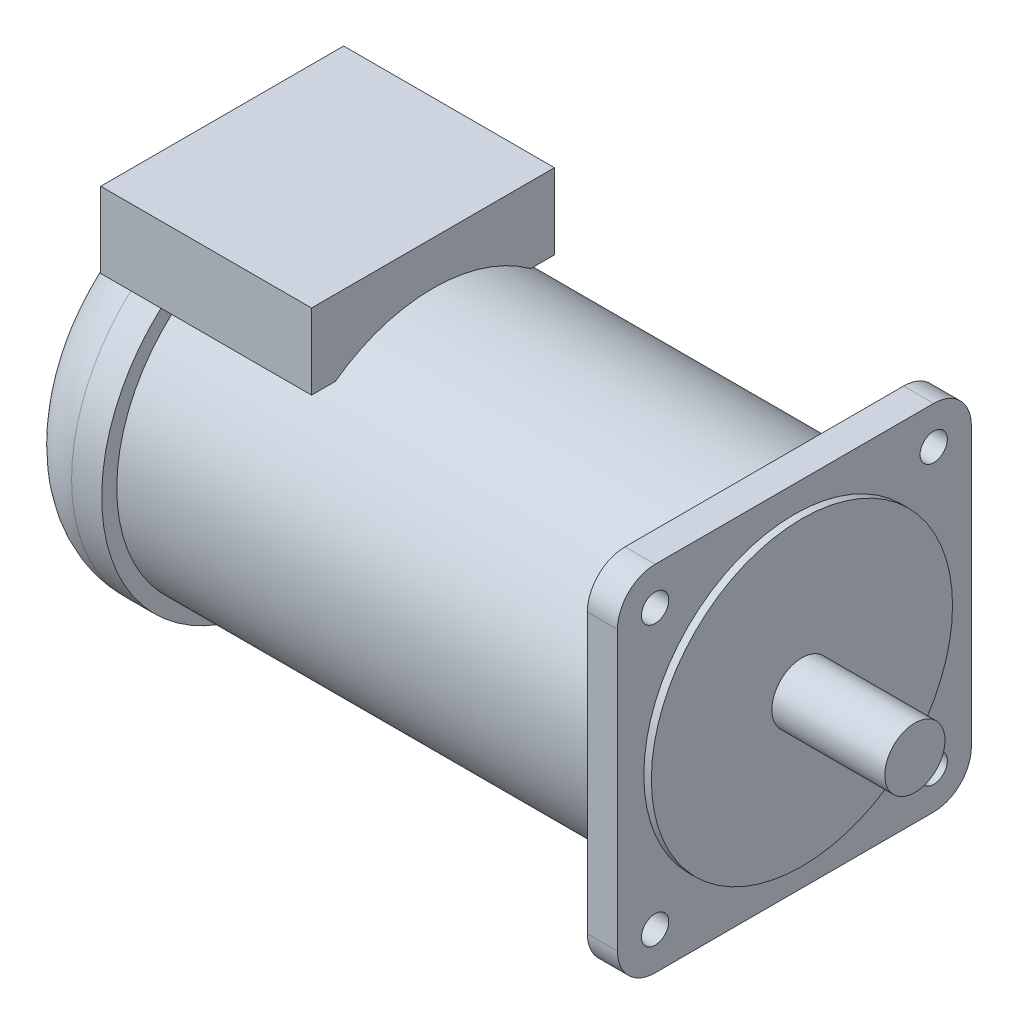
SolidWorks part; units mm, degrees
ref_plane "front" through (0, 0, 0) normal (0, 0, 1) x (1, 0, 0)
ref_plane "top" through (0, 0, 0) normal (0, 1, 0) x (1, 0, 0)
ref_plane "side" through (0, 0, 0) normal (1, 0, 0) x (0, 0, -1)
sketch "Sketch1" plane through (0, 0, 0) normal (0, 0, 1) x (1, 0, 0)
  line L0 (0, 0) -> (63.4876, 0) construction
  line L1 (0, 0) -> (0, 12.7)
  line L2 (0, 12.7) -> (-50.8, 12.7)
  line L3 (-50.8, 12.7) -> (-50.8, 69.85)
  line L6 (-50.8, 69.85) -> (-266.7, 69.85)
  line L7 (-266.7, 69.85) -> (-266.7, 76.2)
  line L8 (-266.7, 76.2) -> (-279.4, 76.2)
  line L9 (-304.8, 50.8) -> (-304.8, 0)
  line L10 (-304.8, 0) -> (0, 0)
  arc A0 (-279.4, 76.2) -> (-304.8, 50.8) centre (-279.4, 50.8) ccw
  dimension "D3" = 25.4
  dimension "D1" = 69.85
  dimension "D2" = 76.2
  dimension "D4" = 38.1
  dimension "D5" = 254
  dimension "D6" = 50.8
  dimension "D7" = 25.4
revolve "Base-Revolve" add sketch "Sketch1" angle 360 about L0
sketch "Sketch2" plane through (-50.8, 0, 0) normal (1, 0, 0) x (0, 0, -1)
  line L0 (0, 0) -> (0, 105.8986) construction
  line L1 (0, 0) -> (105.8986, 0) construction
  line L2 (74.6125, -58.7375) -> (74.6125, 58.7375)
  line L3 (58.7375, 74.6125) -> (-58.7375, 74.6125)
  line L4 (-74.6125, -58.7375) -> (-74.6125, 58.7375)
  line L5 (58.7375, -74.6125) -> (-58.7375, -74.6125)
  arc A0 (74.6125, 58.7375) -> (58.7375, 74.6125) centre (58.7375, 58.7375) ccw
  arc A1 (-74.6125, 58.7375) -> (-58.7375, 74.6125) centre (-58.7375, 58.7375) cw
  arc A2 (-74.6125, -58.7375) -> (-58.7375, -74.6125) centre (-58.7375, -58.7375) ccw
  arc A3 (74.6125, -58.7375) -> (58.7375, -74.6125) centre (58.7375, -58.7375) cw
  point P10 (0, 74.6125)
  point P11 (74.6125, 0)
  point P18 (-74.6125, 0)
  point P19 (0, -74.6125)
  dimension "D1" = 15.875
  dimension "D2" = 149.225
extrude "Boss-Extrude1" add sketch "Sketch2" against normal blind 12.7
ref_plane "Plane4" through (-203.2, 0, 0) normal (1, 0, 0) x (0, 0, -1)
sketch "Sketch3" plane through (-203.2, 0, 0) normal (1, 0, 0) x (0, 0, -1)
  line L0 (0, 0) -> (0, 88.2412) construction
  line L1 (-51.2239, 88.2412) -> (51.2239, 88.2412)
  line L2 (-51.2239, 88.2412) -> (-51.2239, 56.4141)
  line L3 (51.2239, 56.4141) -> (-51.2239, 56.4141)
  line L4 (51.2239, 56.4141) -> (51.2239, 88.2412)
  circle A0 centre (0, 0) radius 76.2 construction
extrude "Boss-Extrude2" add sketch "Sketch3" against normal blind 88.9
sketch "Sketch4" plane through (-50.8, 0, 0) normal (1, 0, 0) x (0, 0, -1)
  circle A0 centre (0, 0) radius 63.5
  dimension "D1" = 127
extrude "pilot dia" add sketch "Sketch4" along normal blind 3.175
hole_wizard "1/2-20 Tapped Hole2" positions "Sketch6" profile "Sketch5" tap size "1/2-20" standard "Ansi Inch"
sketch "Sketch6" plane through (-63.5, 0, 0) normal (-1, 0, 0) x (0, 0, 1)
  point P0 (58.7375, 58.7375)
sketch "Sketch5" plane through (-63.5, 58.7375, 58.7375) normal (0, 1, 0) x (0, 0, 1)
  line L0 (0, 0) -> (0, 63.5)
  line L1 (0, 63.5) -> (5.7544, 63.5)
  line L2 (5.7544, 63.5) -> (5.7544, 0)
  line L5 (5.7544, 0) -> (0, 0)
  line L11 (0, -6.35) -> (0, 107.95) construction
  dimension "Thru Hole Dia." = 11.5087
  dimension "Thru Hole Depth" = 63.5
pattern_circular "CirPattern2" count 4 over 360 about axis through (0, 0, 0) along (1, 0, 0) of "1/2-20 Tapped Hole2"
